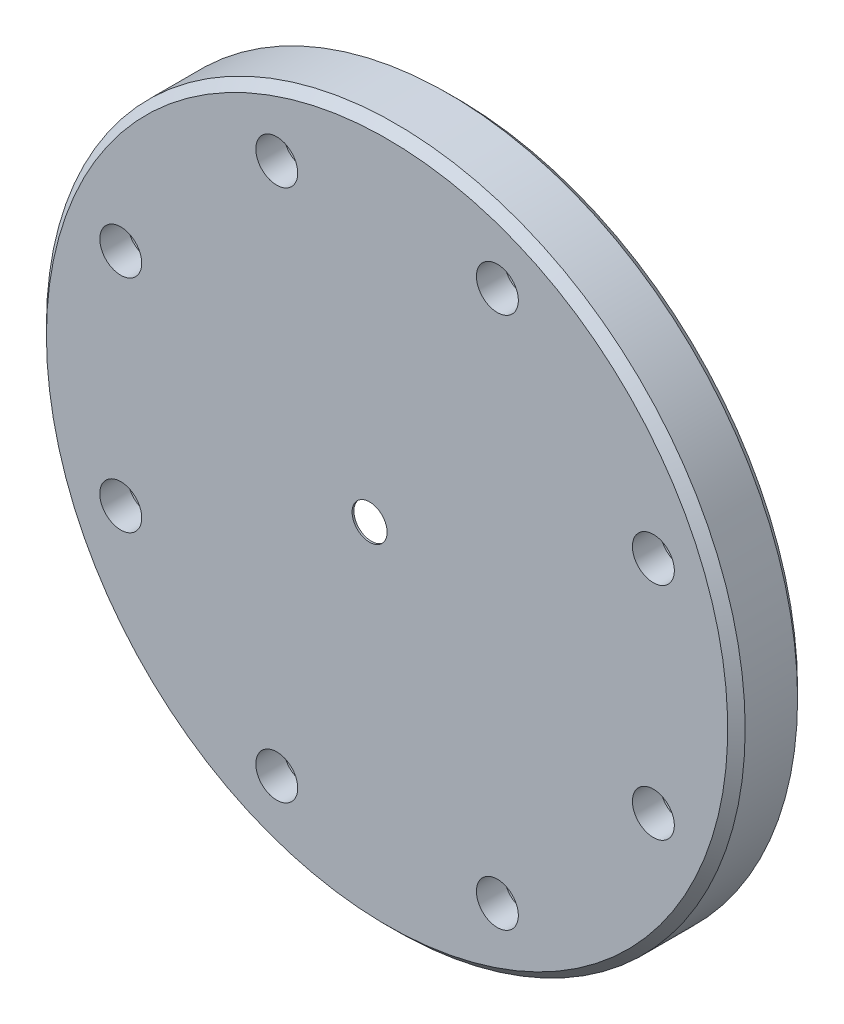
SolidWorks part; units mm, degrees
ref_plane "Plan1" through (0, 0, 0) normal (0, 0, 1) x (1, 0, 0)
ref_plane "Plan2" through (0, 0, 0) normal (0, 1, 0) x (1, 0, 0)
ref_plane "Plan3" through (0, 0, 0) normal (1, 0, 0) x (0, 0, -1)
sketch "Esquisse1" plane through (0, 0, 0) normal (1, 0, 0) x (0, 0, -1)
  line L0 (-8.203, 0) -> (6.2335, 0) construction
  line L1 (1.65, 0) -> (-1.65, 0) construction
  line L2 (0, 20) -> (0, 0)
  line L3 (0, 0) -> (4, 0)
  line L5 (4, 0) -> (4, 20)
  line L6 (4, 20) -> (0, 20)
  line L7 (0, 22) -> (0, -22) construction
  dimension "D4" = 4
  dimension "D5" = 40
revolve "Révolution1" add sketch "Esquisse1" angle 360 about L0
sketch "Esquisse2" plane through (0, 0, 0) normal (0, 1, 0) x (1, 0, 0)
  line L0 (-7.6182, 6.4868) -> (6.3285, -7.4599) construction
  line L1 (-3.6518, 3.9346) -> (-4.3589, 3.2275)
  line L2 (-3.6518, 3.9346) -> (5.6316, -5.3488)
  line L3 (-4.3589, 3.2275) -> (4.9245, -6.0559)
  line L4 (5.6316, -5.3488) -> (4.9245, -6.0559)
  line L5 (0, -1.1) -> (0, 1.1) construction
  dimension "D1" = 2
  dimension "D2" = 0.8
  dimension "D3" = 45
revolve "Enlèvement de matière-Révolution1" [suppressed] cut sketch "Esquisse2" angle 360 about L0
ref_plane "Plan4" [suppressed] through (0, 0, 0) normal (-0.7071, 0, -0.7071) x (-0.7071, 0, 0.7071)
hole_wizard "Chambrage pour vis à tête hexagonale M21" positions "Esquisse5" profile "Esquisse4" counterbore size "M2" standard "ISO"
sketch "Esquisse5" plane through (0, 0, -4) normal (0, 0, -1) x (-1, 0, 0)
  line L0 (0, 0) -> (6.3143, 15.244)
  line L2 (0, 2.2) -> (0, -2.2) construction
  circle A1 centre (0, 0) radius 16.5
  point P7 (6.3143, 15.244)
  dimension "D1" = 33
  dimension "D2" = 22.5
sketch "Esquisse4" plane through (-6.3143, 15.244, -4) normal (1, 0, 0) x (0, 1, 0)
  line L0 (0, 0) -> (0, 4)
  line L1 (0, 4) -> (1.2, 4)
  line L3 (1.2, 4) -> (1.2, 2.4)
  line L4 (1.2, 2.4) -> (2.2, 2.4)
  line L5 (2.2, 2.4) -> (2.2, 0)
  line L7 (2.2, 0) -> (0, 0)
  line L11 (0, -6.35) -> (0, 107.95) construction
  dimension "Diamètre du perçage jusqu'au prochain" = 2.4
  dimension "Profondeur du perçage jusqu'au prochain" = 4
  dimension "Diamètre du chambrage" = 4.4
  dimension "Profondeur du chambrage" = 2.4
sketch "Esquisse6" plane through (0, 0, 0) normal (0, 1, 0) x (1, 0, 0)
  line L0 (-1, 7.1863) -> (-1, -1.064) construction
  line L1 (-1, 4) -> (-16.555, 4)
  line L2 (-16.555, 4) -> (-2, 0.1)
  line L3 (-2, 0) -> (-1, 0)
  line L4 (-1, 0) -> (-1, 4)
  line L5 (-20, 0) -> (20, 0) construction
  line L6 (20, 4) -> (-20, 4) construction
  line L7 (0, -2.2) -> (0, 2.2) construction
  line L8 (-2, 0.1) -> (-2, 0)
  dimension "D1" = 1
  dimension "D2" = 2
  dimension "D3" = 0.1
  dimension "D4" = 75
revolve "Enlèvement de matière-Révolution2" cut sketch "Esquisse6" angle 360 about L0
pattern_circular "Répétition circulaire1" count 8 over 360 about axis through (0, 0, 0) along (0, 0, 1) of "Chambrage pour vis à tête hexagonale M21"
chamfer "Chanfrein1" distance 0.5 angle 45 2 edges at (20, 0, -4) (20, 0, 0)
